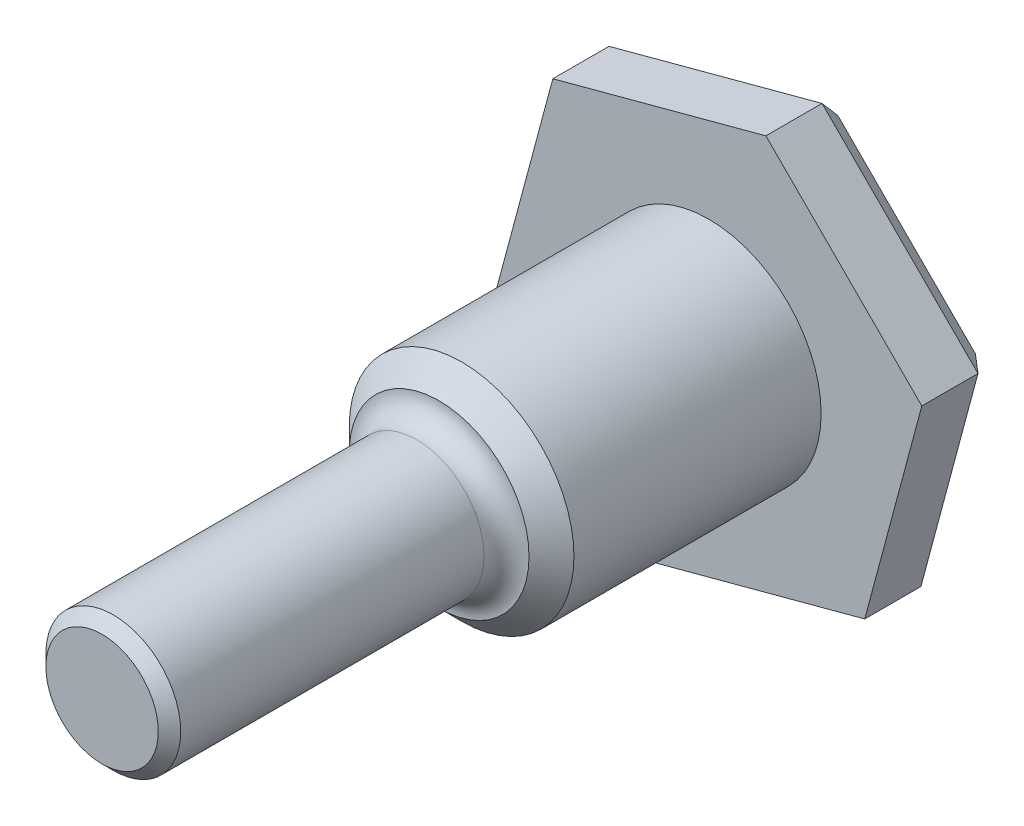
SolidWorks part; units mm, degrees
ref_plane "Plan1" through (0, 0, 0) normal (0, 0, 1) x (1, 0, 0)
ref_plane "Plan2" through (0, 0, 0) normal (0, 1, 0) x (1, 0, 0)
ref_plane "Plan3" through (0, 0, 0) normal (1, 0, 0) x (0, 0, -1)
sketch "Esquisse1" plane through (0, 0, 0) normal (0, 0, 1) x (1, 0, 0)
  line L1 (6.9402, -6.9402) -> (9.4805, 2.5403)
  line L2 (9.4805, 2.5403) -> (2.5403, 9.4805)
  line L3 (2.5403, 9.4805) -> (-6.9402, 6.9402)
  line L4 (-6.9402, 6.9402) -> (-9.4805, -2.5403)
  line L5 (-9.4805, -2.5403) -> (-2.5403, -9.4805)
  line L6 (-2.5403, -9.4805) -> (6.9402, -6.9402)
  circle A0 centre (0, 0) radius 8.5 construction
  dimension "D1" = 17
extrude "Base-Extrusion" add sketch "Esquisse1" along normal blind 3.5
sketch "Esquisse2" plane through (0, 0, 3.5) normal (0, 0, 1) x (1, 0, 0)
  circle A0 centre (0, 0) radius 5
  dimension "D1" = 10
extrude "Boss.-Extru.1" add sketch "Esquisse2" along normal blind 12
sketch "Esquisse3" plane through (0, 0, 15.5) normal (0, 0, 1) x (1, 0, 0)
  circle A0 centre (0, 0) radius 3
  dimension "D1" = 6
extrude "Boss.-Extru.2" add sketch "Esquisse3" along normal blind 15
fillet "Congé1" radius 1 1 edges at (3, 0, 15.5)
chamfer "Chanfrein1" distance 1 angle 45 7 edges at (5, 0, 15.5) (-6.0104, -6.0104, 0) (-8.2104, 2.2, 0) (-2.2, 8.2104, 0) (6.0104, 6.0104, 0) (8.2104, -2.2, 0) (2.2, -8.2104, 0)
chamfer "Chanfrein2" distance 0.5 angle 45 1 edges at (3, 0, 30.5)
